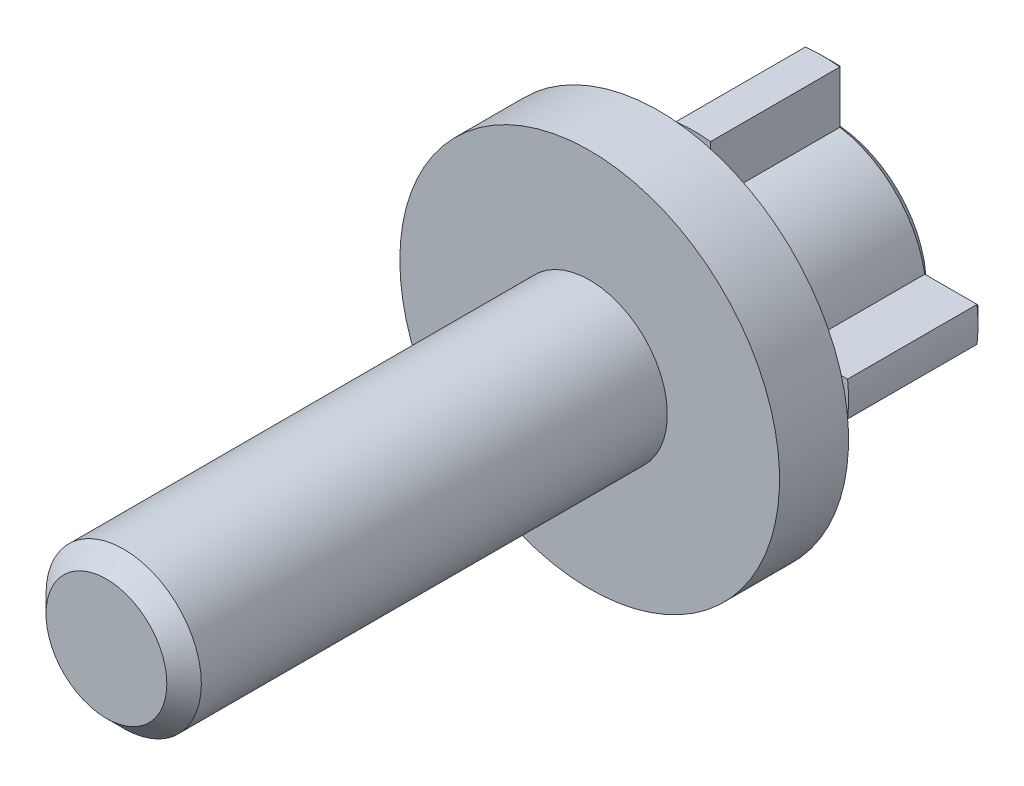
SolidWorks part; units mm, degrees
ref_plane "前视" through (0, 0, 0) normal (0, 0, 1) x (1, 0, 0)
ref_plane "上视" through (0, 0, 0) normal (0, 1, 0) x (1, 0, 0)
ref_plane "右视" through (0, 0, 0) normal (1, 0, 0) x (0, 0, -1)
sketch "草图1" plane through (0, 0, 0) normal (0, 0, 1) x (1, 0, 0)
  circle A0 centre (0, 0) radius 4.5
  dimension "D1" = 9
extrude "拉伸1" add sketch "草图1" along normal blind 28
sketch "草图2" plane through (0, 0, 0) normal (0, 0, -1) x (-1, 0, 0)
  circle A0 centre (0, 0) radius 11
  circle A1 centre (0, 0) radius 4.5 construction
  dimension "D1" = 22
extrude "拉伸2" add sketch "草图2" along normal blind 4
sketch "草图3" plane through (0, 0, -4) normal (0, 0, -1) x (-1, 0, 0)
  circle A0 centre (0, 0) radius 6
  circle A1 centre (0, 0) radius 11 construction
  dimension "D1" = 12
extrude "拉伸3" add sketch "草图3" along normal blind 2
sketch "草图4" plane through (0, 0, -6) normal (0, 0, -1) x (-1, 0, 0)
  line L10 (1, 5.9161) -> (1, 8.9443)
  line L11 (-1, 5.9161) -> (-1, 8.9443)
  line L12 (-5.9161, 1) -> (-8.9443, 1)
  line L13 (-5.9161, -1) -> (-8.9443, -1)
  line L14 (5.9161, -1) -> (8.9443, -1)
  line L15 (5.9161, 1) -> (8.9443, 1)
  line L16 (1, -5.9161) -> (1, -8.9443)
  line L17 (-1, -5.9161) -> (-1, -8.9443)
  arc A0 (-1, 5.9161) -> (-5.9161, 1) centre (0, 0) ccw
  circle A1 centre (0, 0) radius 6 construction
  arc A2 (-8.9443, 1) -> (-8.9443, -1) centre (0, 0) ccw
  arc A3 (-5.9161, -1) -> (-1, -5.9161) centre (0, 0) ccw
  arc A4 (5.9161, 1) -> (1, 5.9161) centre (0, 0) ccw
  arc A5 (1, -5.9161) -> (5.9161, -1) centre (0, 0) ccw
  arc A6 (1, 8.9443) -> (-1, 8.9443) centre (0, 0) ccw
  arc A7 (-1, -8.9443) -> (1, -8.9443) centre (0, 0) ccw
  arc A8 (8.9443, -1) -> (8.9443, 1) centre (0, 0) ccw
  dimension "D1" = 18
  dimension "D2" = 2
extrude "拉伸4" add sketch "草图4" along normal blind 8
chamfer "倒角1" distance 0.5 angle 45
chamfer "倒角2" distance 1 angle 45
sketch "草图5" plane through (0, 0, 0) normal (1, 0, 0) x (0, 0, -1)
  line L0 (15.6545, 0) -> (-29.4758, 0) construction
  line L1 (-27, 0) -> (0, 0) construction
  line L2 (14, 4) -> (15.6545, 4)
  line L4 (14, 0.5) -> (14, 5.4772) construction
  line L5 (14, 4) -> (2, 4)
  line L6 (2, 4) -> (-0.3094, 0)
  line L7 (15.6545, 4) -> (15.6545, 0)
  line L8 (-0.3094, 0) -> (15.6545, 0)
revolve "切除-旋转1" cut sketch "草图5" angle 360 about L0
